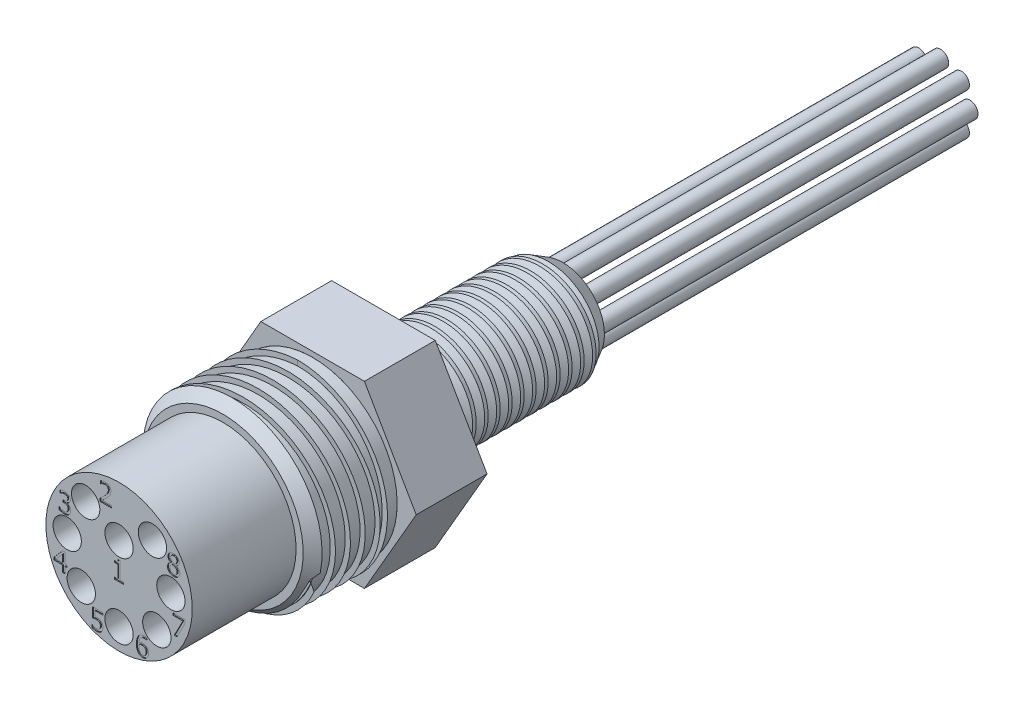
SolidWorks part; units mm, degrees
ref_plane "Front Plane" through (0, 0, 0) normal (0, 0, 1) x (1, 0, 0)
ref_plane "Top Plane" through (0, 0, 0) normal (0, 1, 0) x (1, 0, 0)
ref_plane "Right Plane" through (0, 0, 0) normal (1, 0, 0) x (0, 0, -1)
imported_body "Surface-Imported1"
imported_body "Surface-Imported5"
imported_body "Surface-Imported7" [suppressed]
imported_body "Surface-Imported8" [suppressed]
sketch "Sketch2" plane through (0, 0, -26.5) normal (0, 0, -1) x (-1, 0, 0)
  line L0 (-3.1113, 0) -> (3.1113, 0) construction
  circle A0 centre (3.1113, 0) radius 0.85
  circle A1 centre (2.2, -2.2) radius 0.85 construction
extrude "Boss-Extrude4" add sketch "Sketch2" along normal blind 39.878
sketch "Sketch3" plane through (0, 0, -26.5) normal (0, 0, -1) x (-1, 0, 0)
  line L0 (-2.2, -2.2) -> (2.2, 2.2) construction
  circle A0 centre (2.2, 2.2) radius 0.85
  circle A1 centre (2.2, -2.2) radius 0.85 construction
extrude "Boss-Extrude5" add sketch "Sketch3" along normal up to surface (39.878 mm away) separate body
sketch "Sketch4" plane through (0, 0, -26.5) normal (0, 0, -1) x (-1, 0, 0)
  line L0 (2.7949, 2.8217) -> (2.7589, 2.7858)
  line L1 (3.0084, 2.4788) -> (2.9604, 2.4624)
  line L2 (2.1618, 2.1895) -> (2.7949, 2.8217) construction
  line L3 (2.1618, 2.1895) -> (3.0084, 2.4788) construction
  line L4 (3.9715, 0.019) -> (3.9207, 0.019)
  line L5 (3.8801, -0.3745) -> (3.8345, -0.3521)
  line L6 (0, 0) -> (2.1618, 2.1895) construction
  line L7 (0, 0) -> (3.0768, 0.0195) construction
  arc A0 (2.7949, 2.8217) -> (3.0084, 2.4788) centre (2.1618, 2.1895) cw
  circle A1 centre (2.2, 2.2) radius 0.85 construction
  arc A2 (2.7589, 2.7858) -> (2.9604, 2.4624) centre (2.1618, 2.1895) cw
  arc A3 (3.9715, 0.019) -> (3.8801, -0.3745) centre (3.0768, 0.0195) cw
  arc A4 (3.9207, 0.019) -> (3.8345, -0.3521) centre (3.0768, 0.0195) cw
  dimension "D1" = 0.0051
  dimension "D2" = 0.0508
  dimension "D3" = 0.381
  dimension "D4" = 2
  dimension "D5" = 45
extrude "Boss-Extrude6" add sketch "Sketch4" along normal up to surface (39.878 mm away) separate body
sketch "Sketch6" plane through (0, 0, 0) normal (0, 0, 1) x (1, 0, 0)
  circle A0 centre (0, 0) radius 8.95
  spline S0 degree 3 poles (1.6703, 8.8469) (0, 9.0001) (-1.6703, 8.8469) (-3.3384, 8.3673) (-4.9424, 7.5364) (-6.3737, 6.3737) (-7.5364, 4.9424) (-8.3673, 3.3384) (-8.8469, 1.6703) (-9.0001, 0) (-8.8469, -1.6703) (-8.3673, -3.3384) (-7.5364, -4.9424) (-6.3737, -6.3737) (-4.9424, -7.5364) (-3.3384, -8.3673) (-1.6703, -8.8469) (0, -9.0001) (1.6703, -8.8469) (3.3384, -8.3673) (4.9424, -7.5364) (6.3737, -6.3737) (7.5364, -4.9424) (8.3673, -3.3384) (8.8469, -1.6703) (9.0001, 0) (8.8469, 1.6703) (8.3673, 3.3384) (7.5364, 4.9424) (6.3737, 6.3737) (4.9424, 7.5364) (3.3384, 8.3673) (1.6703, 8.8469) (0, 9.0001) (-1.6703, 8.8469) knots -0.09216 -0.060003 -0.029129 0 0.029129 0.060003 0.09216 0.125 0.15784 0.189997 0.220871 0.25 0.279129 0.310003 0.34216 0.375 0.40784 0.439997 0.470871 0.5 0.529129 0.560003 0.59216 0.625 0.65784 0.689997 0.720871 0.75 0.779129 0.810003 0.84216 0.875 0.90784 0.939997 0.970871 1 1.029129 1.060003 1.09216 only from (0, 8.95) to (0, 8.95) construction
extrude "Boss-Extrude7" add sketch "Sketch6" along normal up to vertex separate body
